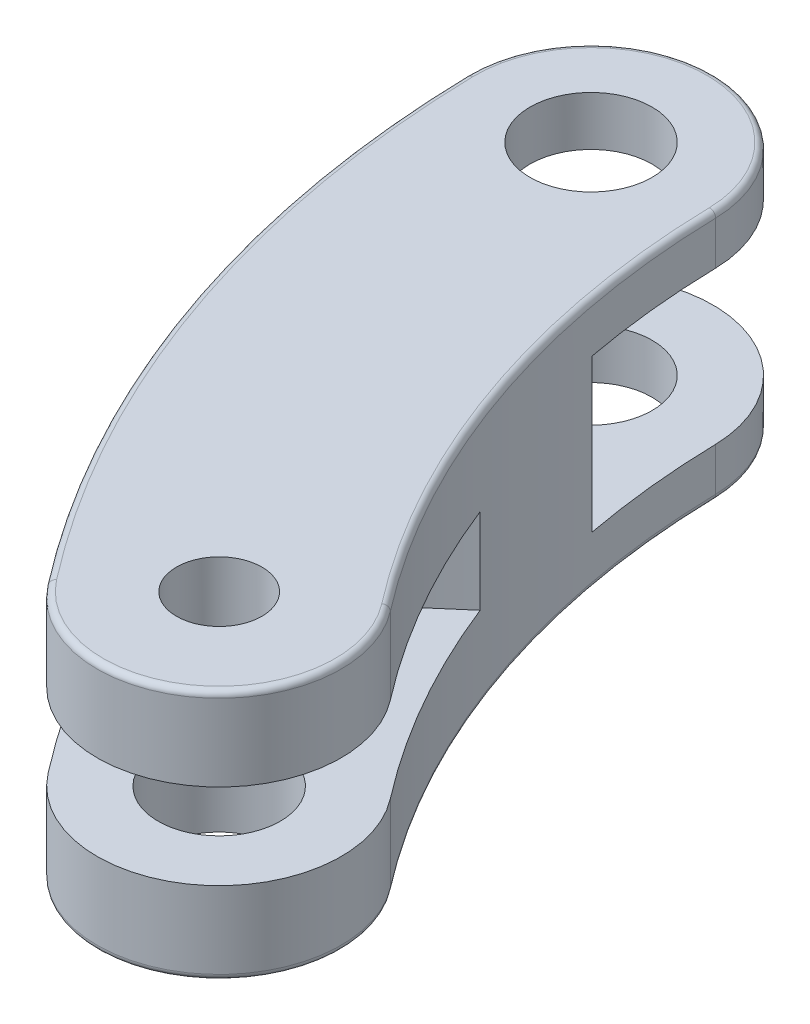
SolidWorks part; units mm, degrees
ref_plane "Plan1" through (0, 0, 0) normal (0, 0, 1) x (1, 0, 0)
ref_plane "Plan2" through (0, 0, 0) normal (0, 1, 0) x (1, 0, 0)
ref_plane "Plan3" through (0, 0, 0) normal (1, 0, 0) x (0, 0, -1)
ref_plane "Plan4" through (0, 612.3344, 0) normal (0, 1, 0) x (-1, 0, 0)
sketch "Esquisse1" plane through (0, 612.3344, 0) normal (0, 1, 0) x (-1, 0, 0)
  arc A0 (-2153.7825, 668.7711) -> (-2133.7873, 669.2105) centre (-2143.7849, 668.9908) ccw
  arc A1 (-2133.7873, 669.2105) -> (-2152.5352, 722.2443) centre (-2223.7656, 667.2331) ccw
  arc A2 (-2152.5352, 722.2443) -> (-2168.3641, 710.0196) centre (-2160.4496, 716.1319) ccw
  arc A3 (-2168.3641, 710.0196) -> (-2153.7825, 668.7711) centre (-2223.7656, 667.2331) cw
extrude "Base-Extrusion" add sketch "Esquisse1" against normal blind 20.6
ref_plane "Plan5" through (1702.8197, 0, -600.989) normal (0.943, 0, -0.3328) x (0, 1, 0)
sketch "Esquisse2" plane through (1702.8197, 0, -600.989) normal (0.943, 0, -0.3328) x (0, 1, 0)
  line L0 (595.7844, 1358.5) -> (595.7844, 1278.5)
  line L1 (595.7844, 1278.5) -> (608.2844, 1278.5)
  line L2 (608.2844, 1278.5) -> (608.2844, 1358.5)
  line L3 (608.2844, 1358.5) -> (595.7844, 1358.5)
  line L4 (595.7844, 1278.5) -> (608.2844, 1278.5) construction
revolve "Enlèvement de matière-Révolution1" cut sketch "Esquisse2" angle 360 about L4
ref_plane "Plan6" through (366.8939, 0, -527.388) normal (-0.5711, 0, 0.8209) x (0, -1, 0)
sketch "Esquisse3" plane through (366.8939, 0, -527.388) normal (-0.5711, 0, 0.8209) x (0, -1, 0)
  line L0 (-598.5344, 2164.8374) -> (-598.5344, 2244.8374)
  line L1 (-598.5344, 2244.8374) -> (-605.5344, 2244.8374)
  line L2 (-605.5344, 2244.8374) -> (-605.5344, 2164.8374)
  line L3 (-605.5344, 2164.8374) -> (-598.5344, 2164.8374)
  line L4 (-598.5344, 2244.8374) -> (-605.5344, 2244.8374) construction
revolve "Enlèvement de matière-Révolution2" cut sketch "Esquisse3" angle 360 about L4
sketch "Esquisse4" plane through (0, 612.3344, 0) normal (0, 1, 0) x (-1, 0, 0)
  circle A0 centre (-2160.4496, 716.1319) radius 3.5
extrude "Enlèv. mat.-Extru.1" cut sketch "Esquisse4" against normal up to next
sketch "Esquisse5" plane through (0, 608.2844, 0) normal (0, -1, 0) x (1, 0, 0)
  circle A0 centre (2143.7849, 668.9908) radius 5
extrude "Enlèv. mat.-Extru.2" cut sketch "Esquisse5" against normal up to next
sketch "Esquisse6" plane through (0, 591.7344, 0) normal (0, -1, 0) x (1, 0, 0)
  circle A0 centre (2160.4496, 716.1319) radius 5
extrude "Enlèv. mat.-Extru.3" cut sketch "Esquisse6" against normal up to next
sketch "Esquisse7" plane through (0, 591.7344, 0) normal (0, -1, 0) x (1, 0, 0)
  circle A0 centre (2143.7849, 668.9908) radius 5
extrude "Enlèv. mat.-Extru.4" cut sketch "Esquisse7" against normal up to next
fillet "Congé1" radius 0.5009
fillet "Congé2" radius 0.501
